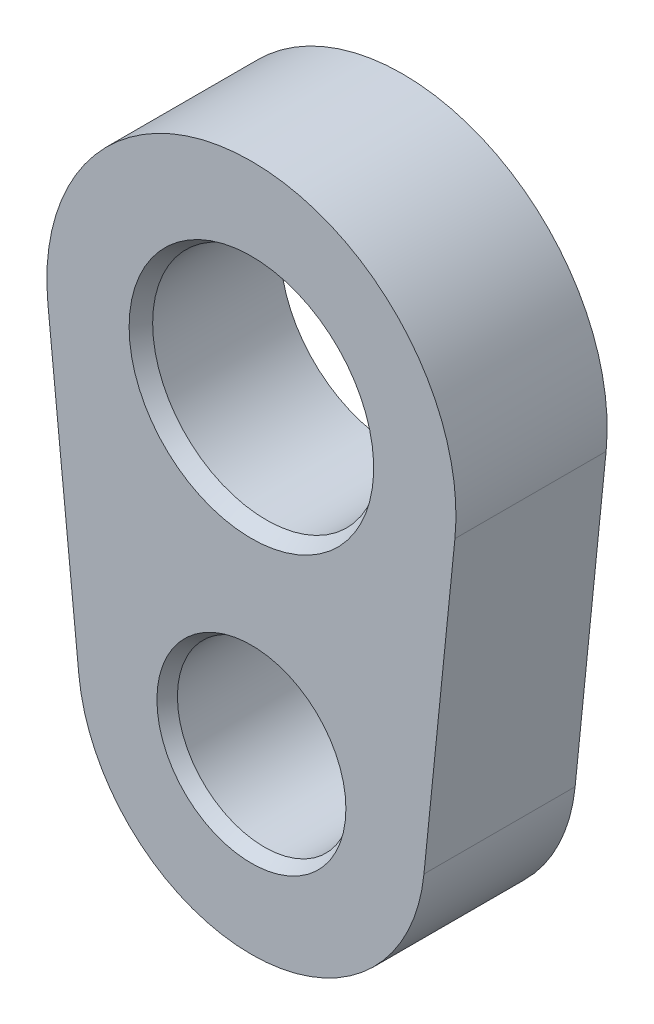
SolidWorks part; units mm, degrees
ref_plane "Front Plane" through (0, 0, 0) normal (0, 0, 1) x (1, 0, 0)
ref_plane "Top Plane" through (0, 0, 0) normal (0, 1, 0) x (1, 0, 0)
ref_plane "Right Plane" through (0, 0, 0) normal (1, 0, 0) x (0, 0, -1)
sketch "Sketch1" plane through (0, 0, 0) normal (0, 0, 1) x (1, 0, 0)
  line L0 (-3.9423, -0.3991) -> (-4.6498, 6.5905)
  line L1 (4.6498, 6.5905) -> (3.9423, -0.3991)
  circle A0 centre (0, 0) radius 1.9875
  circle A1 centre (0, 7.0612) radius 2.5971
  arc A2 (3.9423, -0.3991) -> (-3.9423, -0.3991) centre (0, 0) cw
  arc A3 (-4.6498, 6.5905) -> (4.6498, 6.5905) centre (0, 7.0612) cw
  dimension "D1" = 5.1943
  dimension "D2" = 3.9751
  dimension "D3" = 7.0612
  dimension "D4" = 4.6736
  dimension "D5" = 3.9624
extrude "Boss-Extrude1" add sketch "Sketch1" along normal blind 3.4544
chamfer "Chamfer1" distance 0.1969 angle 60 2 edges at (2.5971, 7.0612, 0) (2.5971, 7.0612, 3.4544)
chamfer "Chamfer2" distance 0.1715 angle 60 2 edges at (1.9875, 0, 0) (1.9875, 0, 3.4544)
